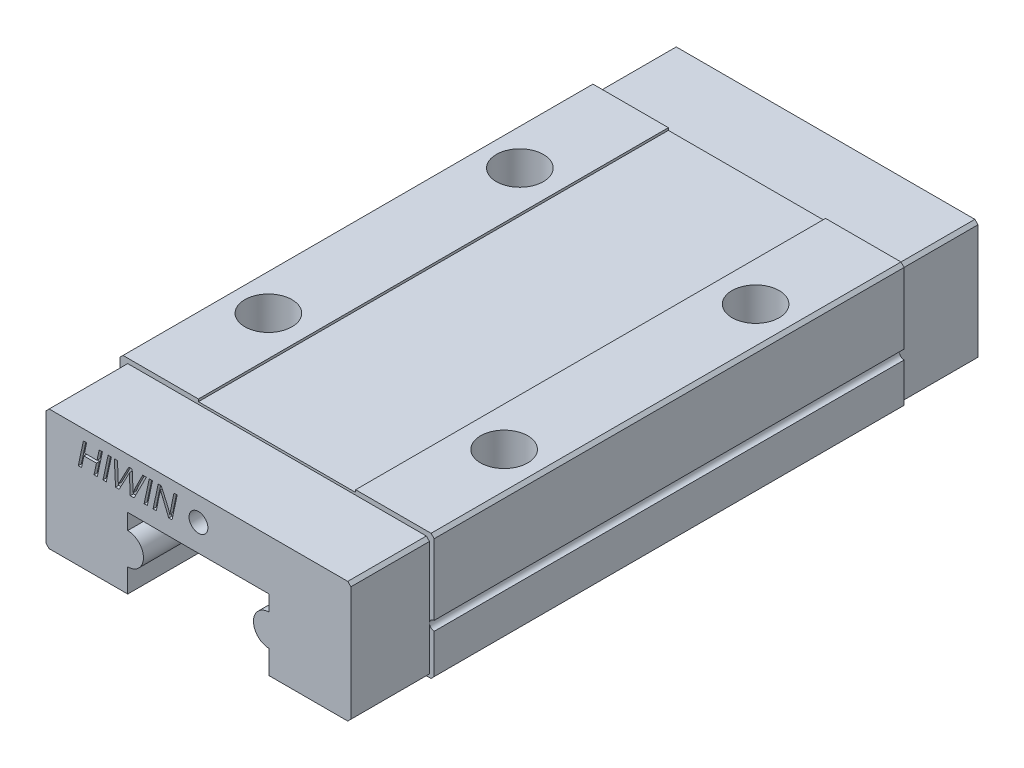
SolidWorks part; units mm, degrees
ref_plane "前视基准面" through (0, 0, 0) normal (0, 0, 1) x (1, 0, 0)
ref_plane "上视基准面" through (0, 0, 0) normal (0, 1, 0) x (1, 0, 0)
ref_plane "右视基准面" through (0, 0, 0) normal (1, 0, 0) x (0, 0, -1)
imported_body "输入1"
chamfer "倒角1" distance 0.2 angle 45
